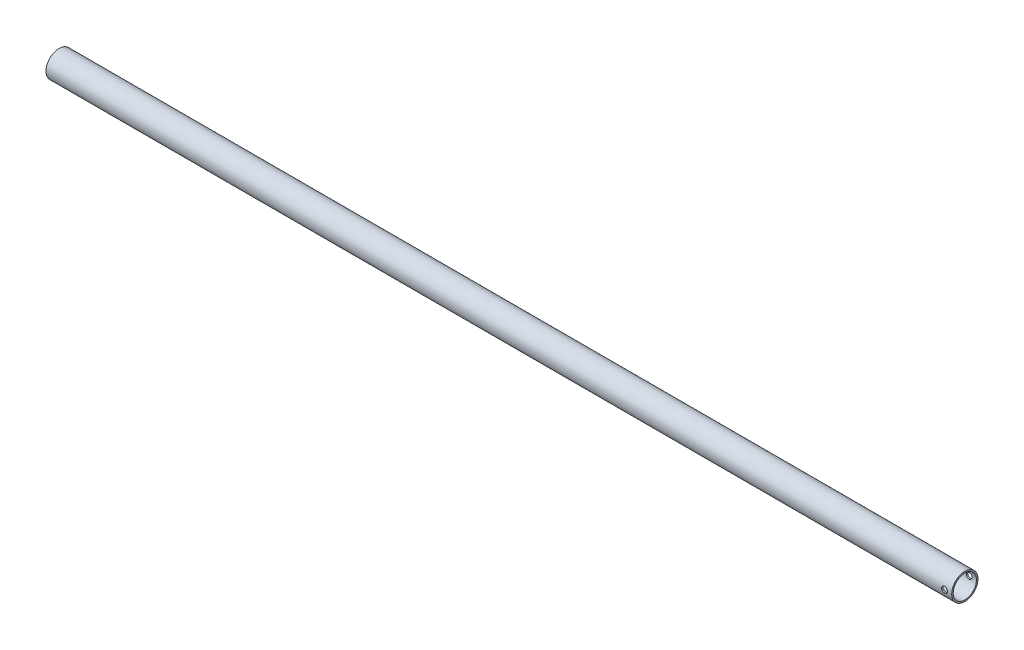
SolidWorks part; units mm, degrees
ref_plane "Front Plane" through (0, 0, 0) normal (0, 0, 1) x (1, 0, 0)
ref_plane "Top Plane" through (0, 0, 0) normal (0, 1, 0) x (1, 0, 0)
ref_plane "Right Plane" through (0, 0, 0) normal (1, 0, 0) x (0, 0, -1)
sketch "Sketch1" plane through (0, 0, 0) normal (0, 0, 1) x (1, 0, 0)
  line L0 (0, 0) -> (-116.3471, 0) construction
  line L1 (0, 12.6365) -> (-984.25, 12.6365)
  line L2 (-984.25, 12.6365) -> (-984.25, 14.2875)
  line L3 (-984.25, 14.2875) -> (0, 14.2875)
  line L4 (0, 14.2875) -> (0, 12.6365)
  circle A0 centre (-7.9248, 0) radius 3.175
  dimension "D5" = 6.35
  dimension "D1" = 28.575
  dimension "D2" = 1.651
  dimension "D3" = 984.25
  dimension "D4" = 7.9248
sketch "Sketch3" plane through (0, 0, 0) normal (0, 0, 1) x (1, 0, 0)
  line L0 (0, 12.6365) -> (-984.25, 12.6365) construction
  line L1 (-984.25, 12.6365) -> (-984.25, 14.2875) construction
  line L2 (-984.25, 14.2875) -> (0, 14.2875) construction
  line L3 (0, 14.2875) -> (0, 12.6365) construction
  line L4 (0, 12.6365) -> (-984.25, 12.6365)
  line L5 (-984.25, 12.6365) -> (-984.25, 14.2875)
  line L6 (-984.25, 14.2875) -> (0, 14.2875)
  line L7 (0, 14.2875) -> (0, 12.6365)
revolve "Revolve1" add sketch "Sketch3" angle 360 about L0
sketch "Sketch4" plane through (0, 0, 0) normal (0, 0, 1) x (1, 0, 0)
  circle A0 centre (-7.9248, 0) radius 3.175 construction
  circle A1 centre (-7.9248, 0) radius 3.175
extrude "Cut-Extrude2" cut sketch "Sketch4" against normal mid plane 50.8
